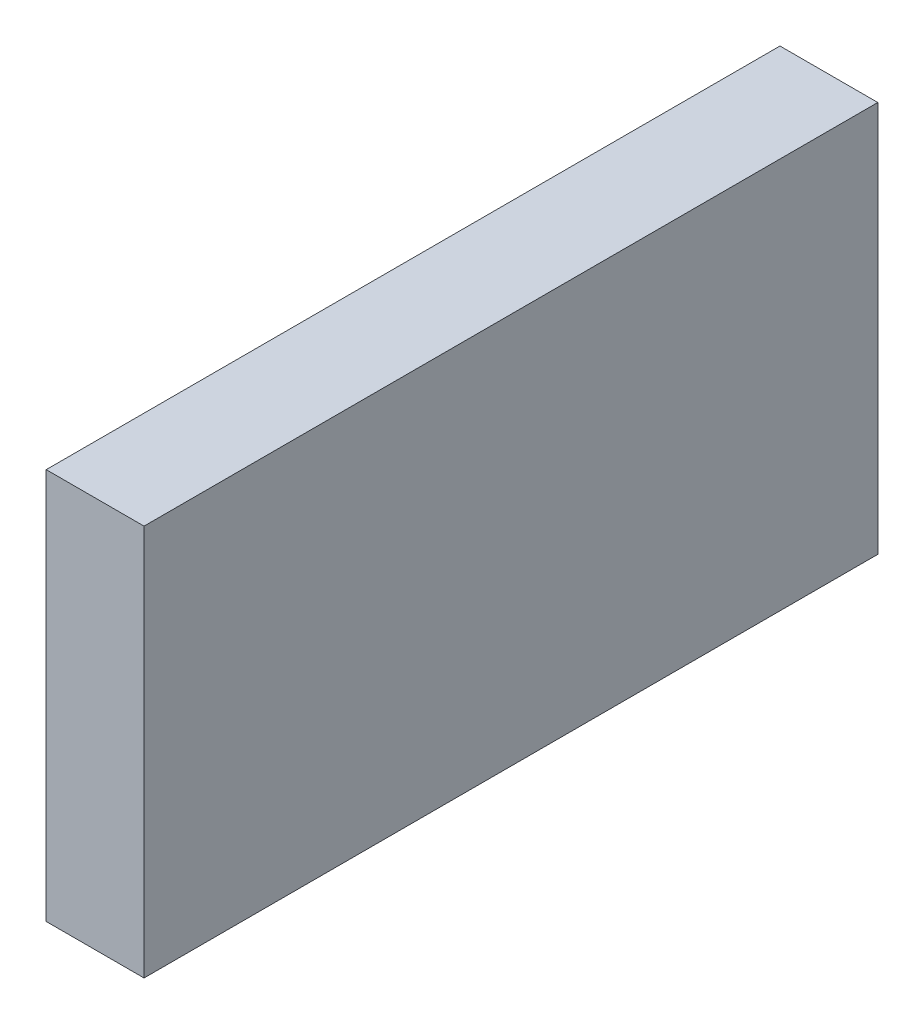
SolidWorks part; units mm, degrees
ref_plane "Face" through (0, 0, 0) normal (0, 0, 1) x (1, 0, 0)
ref_plane "Dessus" through (0, 0, 0) normal (0, 1, 0) x (1, 0, 0)
ref_plane "Droite" through (0, 0, 0) normal (1, 0, 0) x (0, 0, -1)
sketch "Esquisse1" plane through (0, 0, 0) normal (1, 0, 0) x (0, 0, -1)
  line L1 (0, 0) -> (15, 0)
  line L2 (0, 0) -> (0, 8)
  line L3 (0, 8) -> (15, 8)
  line L4 (15, 0) -> (15, 8)
  dimension "D1" = 15
  dimension "D2" = 8
extrude "Extrusion1" add sketch "Esquisse1" along normal blind 2
